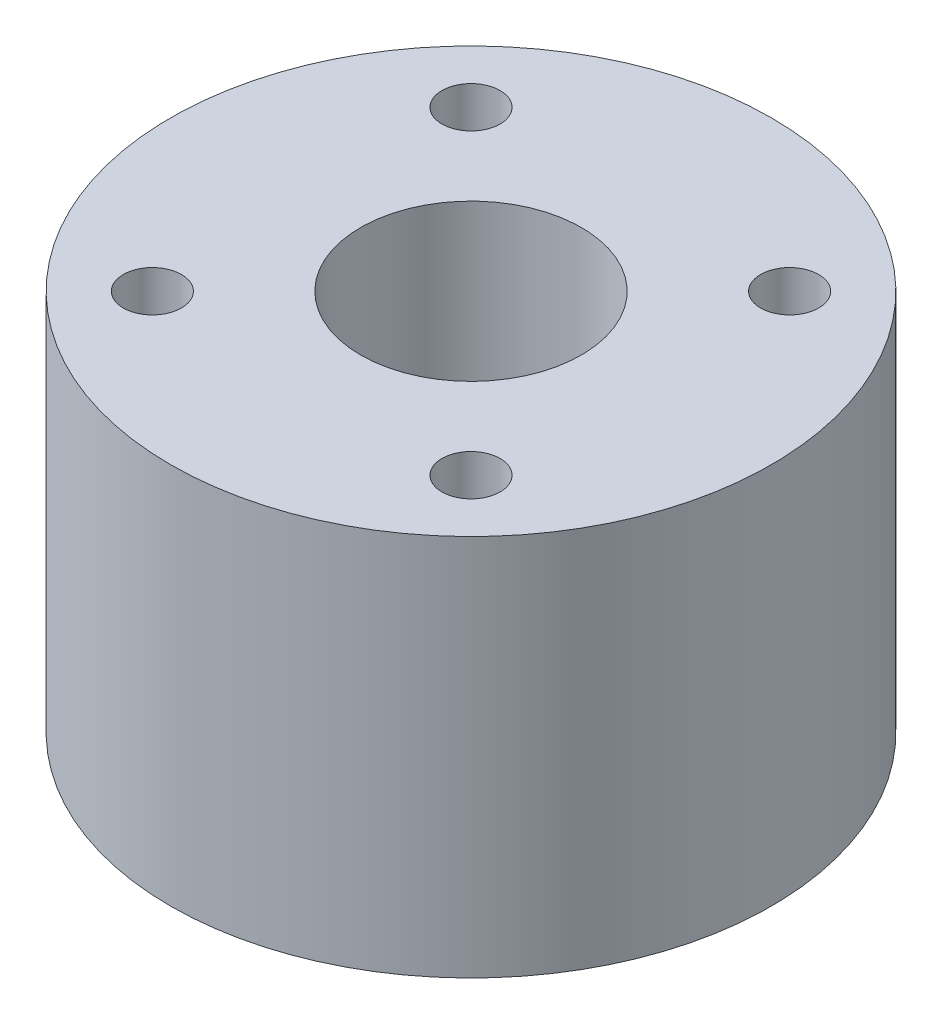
SolidWorks part; units mm, degrees
ref_plane "Front Plane" through (0, 0, 0) normal (0, 0, 1) x (1, 0, 0)
ref_plane "Top Plane" through (0, 0, 0) normal (0, 1, 0) x (1, 0, 0)
ref_plane "Right Plane" through (0, 0, 0) normal (1, 0, 0) x (0, 0, -1)
sketch "Sketch2" plane through (0, 0, 0) normal (0, -1, 0) x (1, 0, 0)
  circle A2 centre (0, 0) radius 34.925
  dimension "D1" = 69.85
extrude "Boss-Extrude2" add sketch "Sketch2" along normal blind 44.45 from offset 0.0102 separate body
hole_wizard "1/4 Clearance Hole1" positions "Sketch8" profile "Sketch7" hole size "1/4" standard "ANSI Inch"
sketch "Sketch8" plane through (0, -0.0102, 0) normal (0, 1, 0) x (-1, 0, 0)
  line L0 (0, 0) -> (-18.5218, 18.5218) construction
  line L1 (0, 0) -> (0, 27.1982) construction
  circle A0 centre (0, 0) radius 26.1937 construction
  point P0 (-18.5218, 18.5218)
  dimension "D1" = 45
  dimension "D2" = 52.3875
sketch "Sketch7" plane through (18.5218, -0.0102, 18.5218) normal (1, 0, 0) x (0, 0, 1)
  line L0 (0, 0) -> (0, 44.45)
  line L1 (0, 44.45) -> (3.3782, 44.45)
  line L2 (3.3782, 44.45) -> (3.3782, 0)
  line L5 (3.3782, 0) -> (0, 0)
  line L11 (0, -6.35) -> (0, 107.95) construction
  dimension "Thru Hole Dia." = 6.7564
  dimension "Thru Hole Depth" = 44.45
pattern_circular "CirPattern1" count 4 over 360 about axis through (0, 0, 0) along (0, 1, 0) of "1/4 Clearance Hole1"
sketch "Sketch9" plane through (0, -0.0102, 0) normal (0, 1, 0) x (1, 0, 0)
  circle A0 centre (0, 0) radius 12.8397
extrude "Cut-Extrude1" cut sketch "Sketch9" against normal blind 32.5437
sketch "Sketch10" plane through (0, -32.5539, 0) normal (0, 1, 0) x (1, 0, 0)
  circle A0 centre (0, 0) radius 3.756
extrude "Cut-Extrude2" cut sketch "Sketch10" against normal through all
equation "\"Buoyancy\"=\"SW-Volume\"*(\"SW-Density\"-.037062)"
